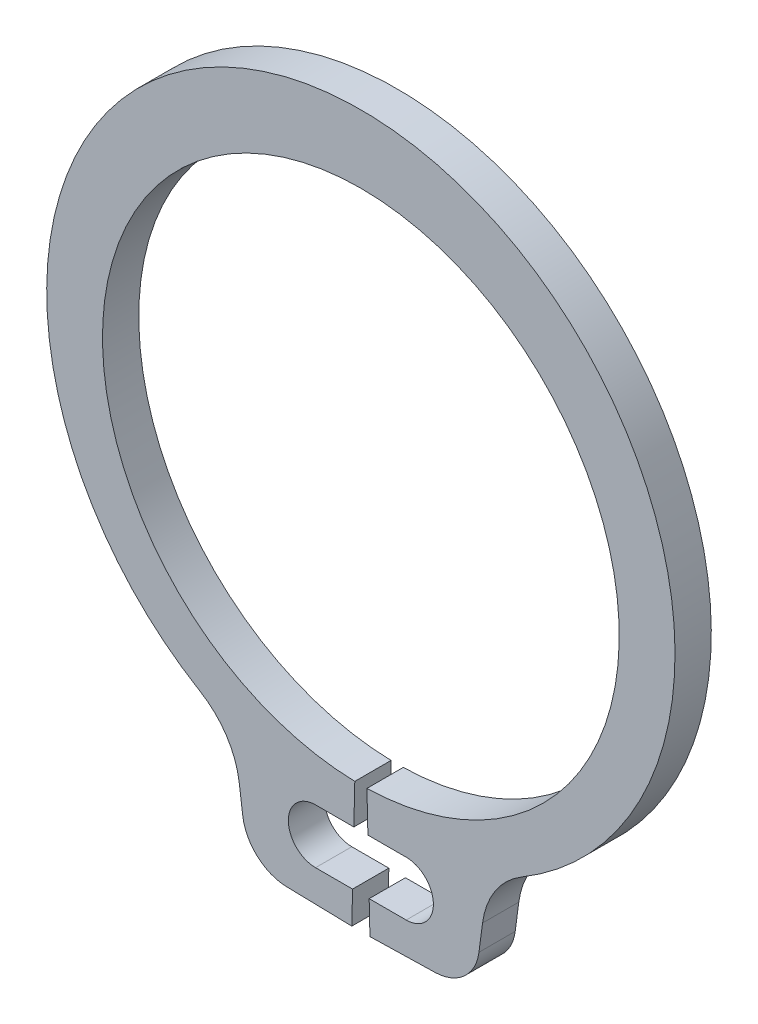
SolidWorks part; units mm, degrees
ref_plane "Plane1" through (0, 0, 0) normal (0, 0, 1) x (1, 0, 0)
ref_plane "Plane2" through (0, 0, 0) normal (0, 1, 0) x (1, 0, 0)
ref_plane "Plane3" through (0, 0, 0) normal (1, 0, 0) x (0, 0, -1)
extrude "Body" add sketch "BodySke" against normal blind 0.4
sketch "BodySke" plane through (0, 0, 0) normal (0, 0, 1) x (1, 0, 0)
  line L0 (-1.5431, 0) -> (1.5431, 0) construction
  line L1 (0, 0) -> (0, 3.6) construction
  line L2 (0.0671, -2.8492) -> (0.1, -4.2488)
  line L3 (-0.0671, -2.8492) -> (-0.1, -4.2488)
  line L4 (0, 0) -> (2.234, -3.6155) construction
  line L5 (0, 0) -> (-2.234, -3.6155) construction
  line L6 (0.1, -4.2488) -> (0.8185, -4.2319)
  line L7 (1.3419, -3.498) -> (1.3025, -3.7973)
  line L8 (-1.3419, -3.498) -> (-1.3025, -3.7973)
  line L9 (-0.1, -4.2488) -> (-0.8185, -4.2319)
  circle A0 centre (0, 0) radius 2.85 construction
  arc A1 (0.0671, -2.8492) -> (-0.0671, -2.8492) centre (0, 0) ccw
  arc A2 (1.761, -2.8498) -> (-1.761, -2.8498) centre (0, 0.1347) ccw construction
  arc A3 (0.1, -4.2488) -> (1.0643, -4.1146) centre (0, 0) ccw construction
  arc A4 (1.7735, -2.8424) -> (1.3419, -3.498) centre (2.234, -3.6155) ccw
  arc A5 (-1.3419, -3.498) -> (-1.7735, -2.8424) centre (-2.234, -3.6155) ccw
  arc A6 (-1.0643, -4.1146) -> (-0.1, -4.2488) centre (0, 0) ccw construction
  arc A7 (1.7735, -2.8424) -> (-1.7735, -2.8424) centre (0, 0.1347) ccw
  arc A8 (-1.36, -3.3602) -> (1.36, -3.3602) centre (0, 0) ccw construction
  circle A9 centre (0.5, -3.5904) radius 0.3
  circle A10 centre (-0.5, -3.5904) radius 0.3
  arc A11 (1.3025, -3.7973) -> (0.8185, -4.2319) centre (0.8068, -3.7321) cw
  arc A12 (-1.3025, -3.7973) -> (-0.8185, -4.2319) centre (-0.8068, -3.7321) ccw
  point P28 (1.2684, -4.0563)
  point P31 (-1.2684, -4.0563)
  dimension "GrooveDia" = 5.7
  dimension "D3" = 0.5
  dimension "LugRad" = 4.25
  dimension "HoleOffsetRad" = 3.625
  dimension "HoleDia" = 0.6
  dimension "D2" = 15
  dimension "LargeRad" = 3.6
  dimension "SmallRad" = 3.35
  dimension "Gap" = 0.2
  dimension "SmallAngle" = 63.425
  dimension "HoleSpacing" = 1
sketch "Clipboard" plane through (0, 0, 0) normal (0, 0, 1) x (1, 0, 0)
  line L0 (0, 0) -> (0.75, 0)
  line L1 (0, 0) -> (0, 0.5)
  line L2 (0, 0) -> (0, -1.4)
  circle A0 centre (0, 0) radius 0.3
  circle A1 centre (0, 0) radius 3
  dimension "HoleDia" = 0.6
  dimension "ShaftDia" = 6
  dimension "LargeSection" = 0.75
  dimension "SmallSection" = 0.5
  dimension "LugSection" = 1.4
sketch "NotSke" plane through (0, 0, 0) normal (0, 0, 1) x (1, 0, 0)
  line L0 (0.5, -3.2904) -> (0.5, -3.8904)
  line L1 (0.5, -3.8904) -> (-0.5, -3.8904)
  line L2 (-0.5, -3.8904) -> (-0.5, -3.2904)
  line L3 (-0.5, -3.2904) -> (0.5, -3.2904)
  circle A0 centre (0.5, -3.5904) radius 0.3 construction
  circle A1 centre (-0.5, -3.5904) radius 0.3 construction
extrude "Notch" cut sketch "NotSke" against normal through all
equation "' \"ShaftDia@Clipboard\" = 4"
equation "' \"Thickness@Body\" = 0.25"
equation "' \"GrooveDia@BodySke\" = 3.8"
equation "' \"LugSection@Clipboard\" = 1.35"
equation "' \"LargeSection@Clipboard\" = 0.65"
equation "' \"SmallSection@Clipboard\" = 0.4"
equation "' \"HoleDia@Clipboard\" = 0.6"
equation "' \"ShaftDia@Clipboard\" = 15"
equation "' \"Thickness@Body\" = 0.9"
equation "' \"GrooveDia@BodySke\" = 14.15"
equation "' \"LugSection@Clipboard\" = 2.8"
equation "' \"LargeSection@Clipboard\" = 1.8"
equation "' \"SmallSection@Clipboard\" = 1.05"
equation "' \"HoleDia@Clipboard\" = 1.2"
equation "\"Gap@BodySke\" =  \"Thickness@Body\" / 2"
equation "\"LargeRad@BodySke\" =  \"GrooveDia@BodySke\" / 2 +  \"LargeSection@Clipboard\""
equation "\"SmallRad@BodySke\" =  \"GrooveDia@BodySke\" / 2 +  \"SmallSection@Clipboard\""
equation "\"LugRad@BodySke\" = \"GrooveDia@BodySke\" / 2 + \"LugSection@Clipboard\""
equation "\"HoleOffsetRad@BodySke\" = (  \"ShaftDia@Clipboard\" / 2 + \"LugRad@BodySke\" ) / 2"
equation "\"HoleSpacing@BodySke\" = \"Gap@BodySke\"  * 2 +  \"HoleDia@Clipboard\""
equation "\"HoleDia@BodySke\" =  \"HoleDia@Clipboard\""
equation "\"SmallAngle@BodySke\" = atn(\"HoleSpacing@BodySke\" / 2 / sqr(\"HoleOffsetRad@BodySke\"  * \"HoleOffsetRad@BodySke\" - (\"HoleSpacing@BodySke\" / 2) * (\"HoleSpacing@BodySke\" / 2) ))  * 8 * ( 180 / 3.141593)"
